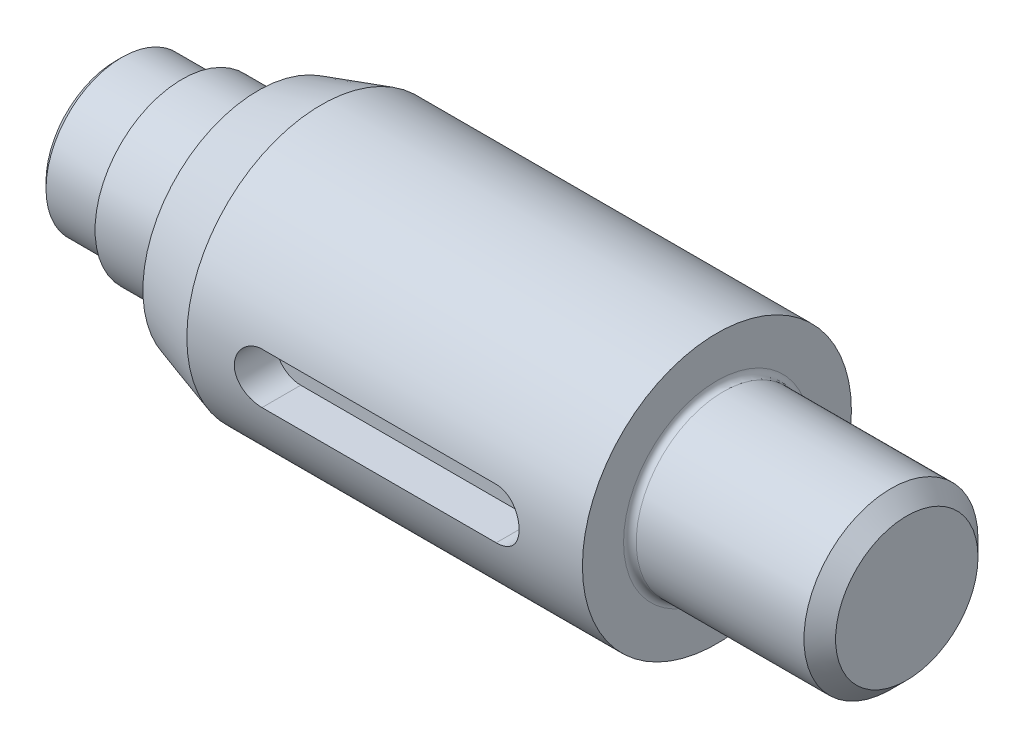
SolidWorks part; units mm, degrees
ref_plane "Płaszczyzna przednia" through (0, 0, 0) normal (0, 0, 1) x (1, 0, 0)
ref_plane "Płaszczyzna górna" through (0, 0, 0) normal (0, 1, 0) x (1, 0, 0)
ref_plane "Płaszczyzna prawa" through (0, 0, 0) normal (1, 0, 0) x (0, 0, -1)
sketch "Szkic1" plane through (0, 0, 0) normal (0, 0, 1) x (1, 0, 0)
  line L0 (0, 0) -> (0, 24)
  line L1 (0, 24) -> (19, 24)
  line L2 (19, 24) -> (19, 20)
  line L3 (19, 20) -> (21, 20)
  line L4 (21, 20) -> (21, 27.5)
  line L5 (21, 27.5) -> (45, 27.5)
  line L6 (45, 27.5) -> (45, 36.3854)
  line L7 (45, 36.3854) -> (65, 42.5)
  line L8 (65, 42.5) -> (190, 42.5)
  line L9 (190, 42.5) -> (190, 27.5)
  line L10 (190, 27.5) -> (250, 27.5)
  line L11 (250, 27.5) -> (250, 0)
  line L12 (250, 0) -> (0, 0)
  line L13 (0, 0) -> (-50.696, 0) construction
  dimension "D1" = 48
  dimension "D2" = 40
  dimension "D3" = 55
  dimension "D4" = 85
  dimension "D5" = 55
  dimension "D6" = 2
  dimension "D7" = 24
  dimension "D8" = 45
  dimension "D9" = 20
  dimension "D10" = 60
  dimension "D11" = 250
  dimension "D12" = 17
revolve "Obrót1" add sketch "Szkic1" angle 360 about L13
ref_plane "Płaszczyzna1" through (0, 0, -42.5) normal (0, 0, -1) x (-1, 0, 0)
sketch "Szkic2" plane through (0, 0, -42.5) normal (0, 0, 1) x (1, 0, 0)
  line L0 (88, 0) -> (162, 0) construction
  line L1 (88, 8) -> (162, 8)
  line L2 (88, -8) -> (162, -8)
  line L3 (190, -42.5) -> (190, 42.5) construction
  arc A0 (88, 8) -> (88, -8) centre (88, 0) ccw
  arc A1 (162, -8) -> (162, 8) centre (162, 0) ccw
  point P3 (125, 0)
  point P8 (80, 0)
  point P9 (170, 0)
  dimension "D1" = 90
  dimension "D2" = 20
  dimension "D3" = 16
extrude "Wytnij-wyciągnięcie1" cut sketch "Szkic2" along normal through all from offset 72
chamfer "Sfazowanie1" distance 2 angle 45 1 edges at (0, 0, -24)
chamfer "Sfazowanie2" distance 5 angle 45 1 edges at (250, 0, -27.5)
fillet "Zaokrąglenie1" radius 2 1 edges at (190, 0, -27.5)
fillet "Zaokrąglenie2" radius 3 1 edges at (45, 0, -27.5)
